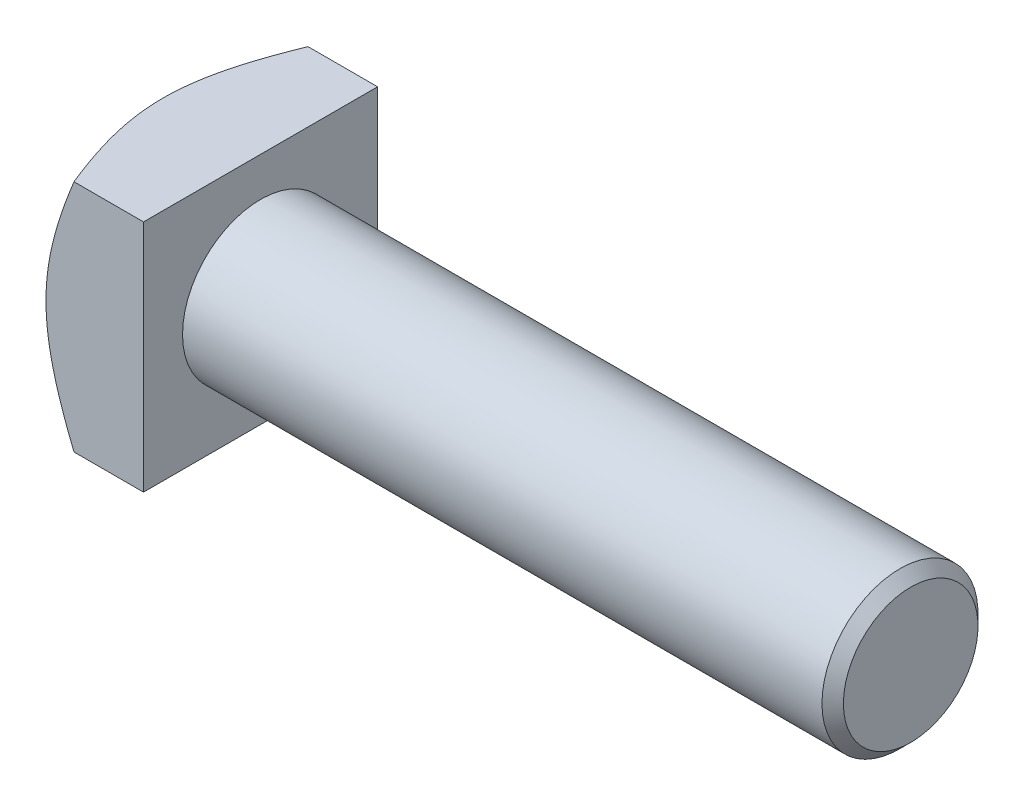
SolidWorks part; units mm, degrees
ref_plane "Plane1" through (0, 0, 0) normal (0, 0, 1) x (1, 0, 0)
ref_plane "Plane2" through (0, 0, 0) normal (0, 1, 0) x (1, 0, 0)
ref_plane "Plane3" through (0, 0, 0) normal (1, 0, 0) x (0, 0, -1)
sketch "Sketch1" plane through (0, 0, 0) normal (1, 0, 0) x (0, 0, -1)
  line L0 (18, 18) -> (18, -18)
  line L1 (-18, 18) -> (-18, -18)
  line L2 (0, 0) -> (22.2214, 0) construction
  line L3 (0, 0) -> (0, 20.1834) construction
  line L4 (-18, 18) -> (18, 18)
  line L5 (-18, -18) -> (18, -18)
  dimension "Width_flats" = 36
extrude "BaseHead" add sketch "Sketch1" along normal blind 15
sketch "BodySke" plane through (0, 0, 0) normal (0, 0, 1) x (1, 0, 0)
  line L0 (0, 18) -> (0, -18) construction
  line L1 (0, 0) -> (115, 0)
  line L2 (0, 0) -> (0, 12)
  line L3 (0, 12) -> (113.352, 12)
  line L4 (115, 0) -> (115, 10.352)
  line L6 (115, 10.352) -> (113.352, 12)
  line L7 (0, 0) -> (96.52, 0) construction
  line L8 (115, -10.352) -> (113.352, -12) construction
  line L9 (0, -12) -> (113.352, -12) construction
  line L10 (18, 15.24) -> (18, -1.27) construction
  line L11 (61, 15.24) -> (61, -1.27) construction
  line L12 (15, 18) -> (15, -18) construction
  line L13 (15, 18) -> (15, -18) construction
  dimension "Length" = 100
  dimension "Body_ch_ang" = 45
  dimension "Diameter" = 24
  dimension "Minor_dia" = 20.704
  dimension "Advance" = 3
  dimension "Thread_nom" = 54
revolve "BaseBody" add sketch "BodySke"
fillet "HeadFillet" [suppressed] radius 0.8
sketch "Sketch3" plane through (0, 0, 0) normal (0, 0, 1) x (1, 0, 0)
  line L0 (0, 18) -> (5.1962, 27)
  line L2 (5.1962, 27) -> (5.1962, 28)
  line L3 (5.1962, 28) -> (-1, 28)
  line L4 (-1, 28) -> (-1, 18)
  line L5 (-1, 18) -> (0, 18)
  line L6 (0, 0) -> (99.06, 0) construction
  line L8 (15, 18) -> (0, 18) construction
  line L9 (0, 18) -> (0, -18) construction
  dimension "D2" = 10
  dimension "D3" = 1
  dimension "D4" = 1
  dimension "Head_ch_ang" = 30
revolve "HeadChamfer" cut sketch "Sketch3" angle 360 about L6
sketch "ThdSchSke" plane through (0, 0, 0) normal (0, 0, 1) x (1, 0, 0)
  line L0 (61, -10.352) -> (59.8461, -12)
  line L1 (61, -10.352) -> (62.1539, -12)
  line L2 (62.1539, -12) -> (62.1539, -15)
  line L3 (-3.175, 0) -> (5.1513, 0) construction
  line L5 (62.1539, -15) -> (59.8461, -15)
  line L6 (59.8461, -15) -> (59.8461, -12)
  dimension "Thread_minor" = 20.704
  dimension "Diameter" = 24
  dimension "Start" = 61
  dimension "SideAngle" = 55
  dimension "VeeAngle" = 70
  dimension "Overcut" = 30
revolve "ThreadSchematic" [suppressed] cut sketch "ThdSchSke" angle 360 about L3
pattern_linear "ThdSchPat" [suppressed]
equation "\"Thread_minor@ThreadCosmetic\" = \"Minor_dia@BodySke\""
equation "\"Thread_length@ThreadCosmetic\" = ((sgn( (\"Length@BodySke\" - \"Advance@BodySke\" * 2 ) - \"Thread_nom@BodySke\" )-1)*( (\"Length@BodySke\" - \"Advance@BodySke\" * 2 ) - \"Thread_nom@BodySke\" ))/-2+ \"Thread_nom@"
equation "\"Thread_minor@ThdSchSke\" = \"Minor_dia@BodySke\""
equation "\"Diameter@ThdSchSke\" = \"Diameter@BodySke\""
equation "\"Overcut@ThdSchSke\" = \"Diameter@BodySke\" * 1.25"
equation "\"Start@ThdSchSke\" = \"Head_ht@BaseHead\" + \"Length@BodySke\" - \"Thread_length@ThreadCosmetic\"  '---Non-countersunk---"
equation "\"Num_threads@ThdSchPat\" = int( \"Thread_length@ThreadCosmetic\" / \"Advance@BodySke\" + 0.999 )  + 1"
equation "\"Advance@ThdSchPat\" = \"Thread_length@ThreadCosmetic\" /  (\"Num_threads@ThdSchPat\" - 1) 'relax it"
equation "\"Num_threads@ThdSchPat\" = \"Num_threads@ThdSchPat\" - sgn( \"Num_threads@ThdSchPat\" - 1) '---chamfered tips only---"
